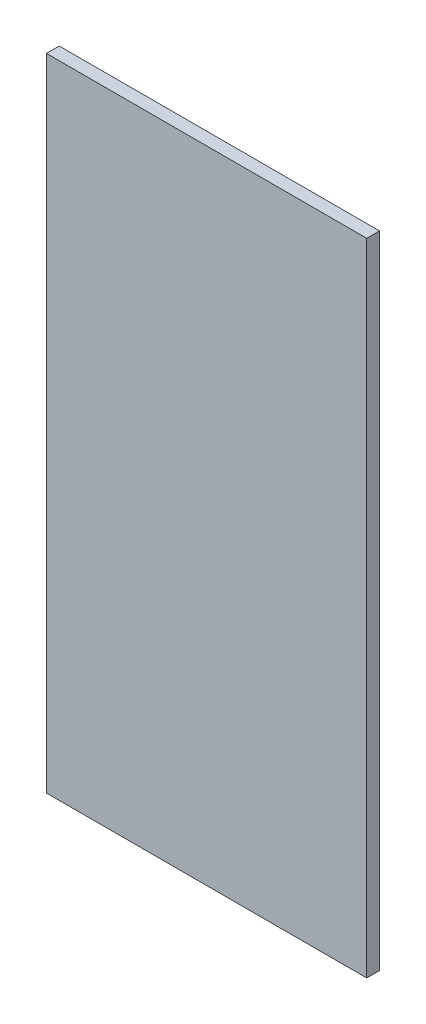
SolidWorks part; units mm, degrees
ref_plane "Vorne" through (0, 0, 0) normal (0, 0, 1) x (1, 0, 0)
ref_plane "Oben" through (0, 0, 0) normal (0, 1, 0) x (1, 0, 0)
ref_plane "Rechts" through (0, 0, 0) normal (1, 0, 0) x (0, 0, -1)
sketch "Skizze2" plane through (0, 0, 0) normal (0, 0, 1) x (1, 0, 0)
  line L1 (0, 0) -> (500, 0)
  line L2 (0, 0) -> (0, 1000)
  line L3 (0, 1000) -> (500, 1000)
  line L4 (500, 0) -> (500, 1000)
  dimension "Breite" = 1000
  dimension "Länge" = 500
extrude "Linear austragen1" add sketch "Skizze2" against normal blind 20
sketch "Skizze3" plane through (0, 0, 0) normal (0, 0, 1) x (1, 0, 0)
  line L1 (107.9252, 120.0218) -> (407.9252, 120.0218)
  line L2 (107.9252, 120.0218) -> (107.9252, 928.1966)
  line L3 (107.9252, 928.1966) -> (407.9252, 928.1966)
  line L4 (407.9252, 120.0218) -> (407.9252, 928.1966)
